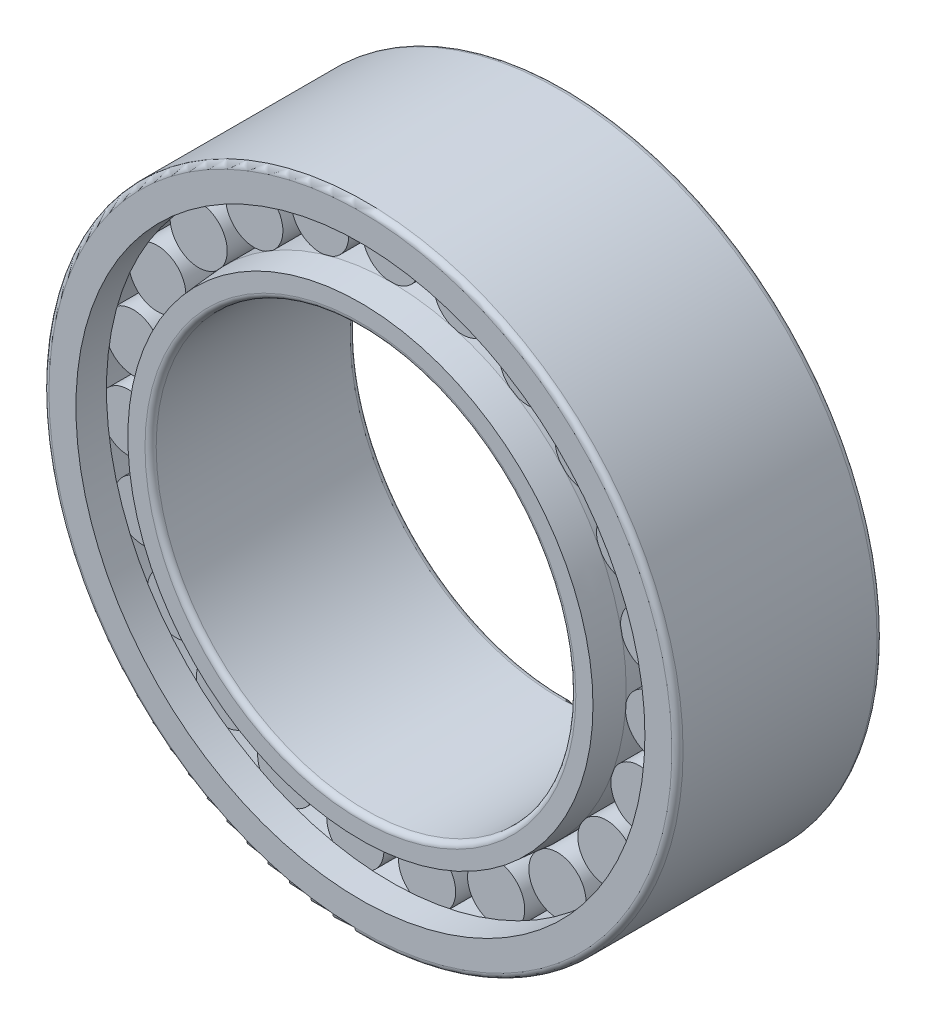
SolidWorks part; units mm, degrees
ref_plane "Front Plane" through (0, 0, 0) normal (0, 0, 1) x (1, 0, 0)
ref_plane "Top Plane" through (0, 0, 0) normal (0, 1, 0) x (1, 0, 0)
ref_plane "Right Plane" through (0, 0, 0) normal (1, 0, 0) x (0, 0, -1)
sketch "BaseSke" plane through (0, 0, 0) normal (1, 0, 0) x (0, 0, -1)
  line L0 (-47.2296, 0) -> (24.6132, 0) construction
  line L1 (-47.2296, 28.25) -> (24.6132, 28.25) construction
  line L2 (0, 129.5214) -> (0, -86.3012) construction
  line L3 (-7.7, 28.25) -> (-7.7, 31.3167) construction
  line L4 (-11, 34) -> (11, 34) construction
  line L5 (-11, 22.5) -> (11, 22.5) construction
  line L6 (-7.7, 25.1833) -> (7.7, 25.1833)
  line L7 (-7.7, 25.1833) -> (-7.7, 28.25)
  line L8 (-7.7, 28.25) -> (7.7, 28.25)
  line L9 (7.7, 25.1833) -> (7.7, 28.25)
  line L10 (-7.7, 31.3167) -> (7.7, 31.3167) construction
  line L11 (7.7, 31.3167) -> (7.7, 28.25) construction
  dimension "D2" = 15.4
  dimension "D1" = 56.5
  dimension "Bearing_Thickness" = 22
  dimension "Bearing_Outside_Diameter" = 68
  dimension "Bearing_Inside_Diameter" = 45
  dimension "D3" = 3.0667
revolve "Roller" add sketch "BaseSke" angle 360 about L8
sketch "OuterRaceSke" plane through (0, 0, 0) normal (1, 0, 0) x (0, 0, -1)
  line L0 (0, 0) -> (0, 87.5396) construction
  line L1 (-11, 34) -> (11, 34)
  line L2 (-11, 34) -> (-11, 30.508)
  line L3 (-11, 30.508) -> (-7.725, 30.508)
  line L4 (11, 34) -> (11, 30.508)
  line L5 (-50.3916, 0) -> (55.2197, 0) construction
  line L6 (-7.7, 31.3167) -> (7.7, 31.3167) construction
  line L7 (7.725, 30.508) -> (11, 30.508)
  line L9 (-7.725, 30.508) -> (-7.725, 31.2747)
  line L10 (-7.725, 31.2747) -> (7.725, 31.2747)
  line L11 (7.725, 30.508) -> (7.725, 31.2747)
  dimension "D1" = 15.45
  dimension "D2" = 0.7667
  dimension "D3" = 0.042
revolve "OuterRace" add sketch "OuterRaceSke" angle 360 about L5
sketch "InnerRaceSke" plane through (0, 0, 0) normal (1, 0, 0) x (0, 0, -1)
  line L0 (-70.8626, 0) -> (113.5527, 0) construction
  line L1 (0, 58.441) -> (0, -70.8113) construction
  line L2 (-11, 22.5) -> (11, 22.5)
  line L3 (-11, 22.5) -> (-11, 25.992)
  line L4 (-7.725, 25.992) -> (-7.725, 25.2253)
  line L5 (-7.725, 25.992) -> (-11, 25.992)
  line L6 (0, 129.5214) -> (0, -86.3012) construction
  line L7 (-7.725, 25.2253) -> (7.725, 25.2253)
  line L9 (11, 22.5) -> (11, 25.992)
  line L10 (7.725, 25.992) -> (11, 25.992)
  line L11 (7.725, 25.2253) -> (7.725, 25.992)
  line L13 (-7.7, 25.1833) -> (7.7, 25.1833) construction
  point P17 (0, 22.5)
  dimension "D2" = 0.042
  dimension "D1" = 15.45
  dimension "D3" = 0.7667
revolve "InnerRace" add sketch "InnerRaceSke" angle 360 about L0
fillet "Fillet1" radius 0.6 4 edges at (22.5, 0, 11) (34, 0, -11) (34, 0, 11) (22.5, 0, -11)
sketch "NJSke" plane through (0, 0, 0) normal (1, 0, 0) x (0, 0, -1)
  line L0 (-35.6078, 0) -> (44.429, 0) construction
  line L1 (11, 25.992) -> (7.725, 25.992)
  line L2 (7.725, 25.992) -> (7.725, 25.2253)
  line L3 (7.725, 25.2253) -> (11, 24.9388)
  line L4 (11, 24.9388) -> (11, 25.992)
  dimension "D1" = 5
revolve "NJ" cut sketch "NJSke" angle 360 about L0
mirror "NU" about plane through (0, 0, 0) normal (0, 0, 1) of "NJ"
pattern_circular "CirPatternBall" count 23 over 360 about axis through (0, 0, 0) along (0, 0, 1) of "Roller"
sketch "SimplifiedSke" plane through (0, 0, 0) normal (1, 0, 0) x (0, 0, -1)
  line L0 (37.5911, 0) -> (-37.5911, 0) construction
  line L1 (-13.1351, 28.25) -> (13.151, 28.25) construction
  line L2 (-7.7, 31.3167) -> (7.7, 31.3167)
  line L3 (-7.7, 31.3167) -> (-7.7, 25.1833)
  line L4 (-7.7, 25.1833) -> (7.7, 25.1833)
  line L5 (7.7, 31.3167) -> (7.7, 25.1833)
  line L6 (-47.2296, 28.25) -> (24.6132, 28.25) construction
revolve "Simplified" [suppressed] add sketch "SimplifiedSke" angle 360 about L0
equation "\"D2@BaseSke\" = \"Bearing_Thickness@BaseSke\"*0.7"
equation "\"D1@BaseSke\" =  ( \"Bearing_Inside_Diameter@BaseSke\" + \"Bearing_Outside_Diameter@BaseSke\" )  / 2"
equation "\"D3@BaseSke\" =  ( \"Bearing_Outside_Diameter@BaseSke\" - \"Bearing_Inside_Diameter@BaseSke\" )  / 7.5"
equation "\"D1@OuterRaceSke\" = \"Bearing_Thickness@BaseSke\"*0.7+0.05"
equation "\"D3@OuterRaceSke\" = 0.02+\"Bearing_Thickness@BaseSke\" * 0.001"
equation "\"D2@OuterRaceSke\" = \"D3@BaseSke\" * 0.25"
equation "\"D1@InnerRaceSke\" = \"Bearing_Thickness@BaseSke\"*0.7+0.05"
equation "\"D2@InnerRaceSke\" = \"D3@OuterRaceSke\""
equation "\"D3@InnerRaceSke\" = \"D2@OuterRaceSke\""
equation "\"D1@CirPatternBall\" =  int(  ( \"Bearing_Outside_Diameter@BaseSke\" + \"Bearing_Inside_Diameter@BaseSke\" )  / 2 *  pi  /  ( \"Bearing_Outside_Diameter@BaseSke\" - \"Bearing_Inside_Diameter@BaseSke\" ) * 3 ) "
